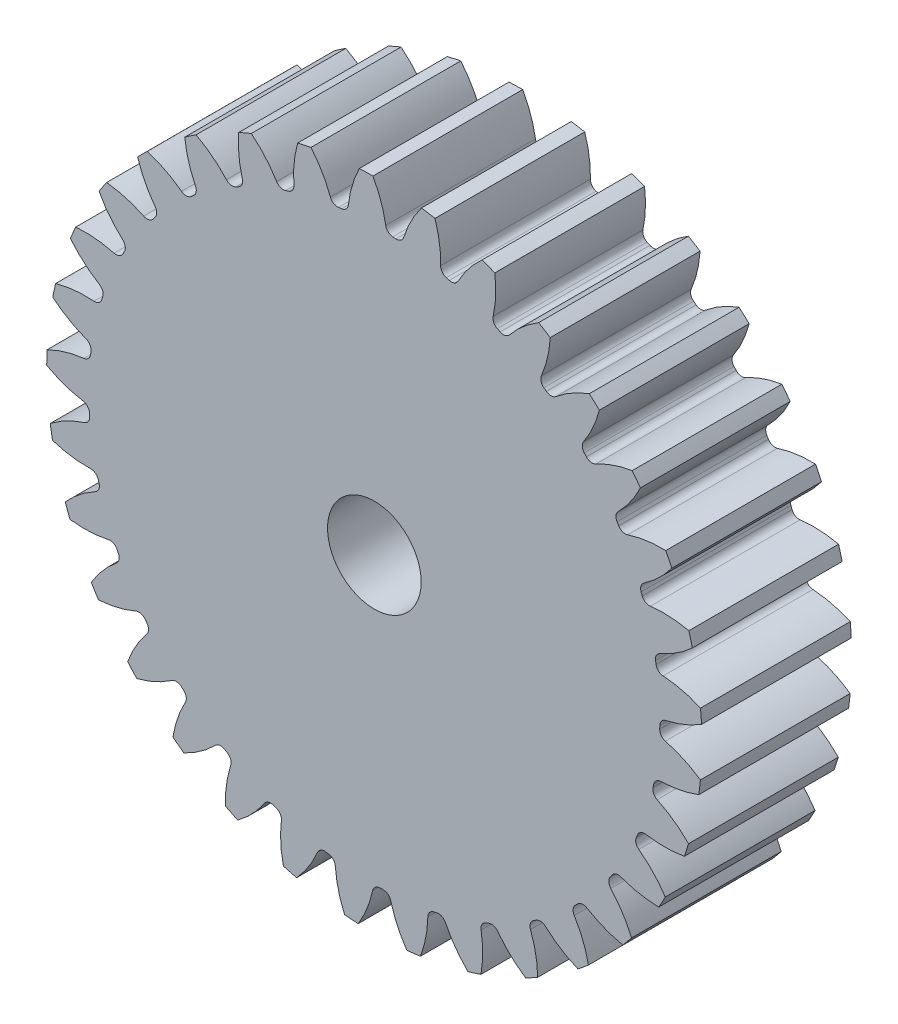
SolidWorks part; units mm, degrees
ref_plane "Front" through (0, 0, 0) normal (0, 0, 1) x (1, 0, 0)
ref_plane "Top" through (0, 0, 0) normal (0, 1, 0) x (1, 0, 0)
ref_plane "Right" through (0, 0, 0) normal (1, 0, 0) x (0, 0, -1)
sketch "Sketch3" plane through (0, 0, 0) normal (0, 0, 1) x (1, 0, 0)
  circle A0 centre (0, 0) radius 222.25
  dimension "od" = 444.5
extrude "gearBody" add sketch "Sketch3" along normal blind 101.6
sketch "Sketch2" plane through (0, 0, 0) normal (0, 0, 1) x (1, 0, 0)
  line L0 (0, 0) -> (181.9235, 75.3552) construction
  line L1 (221.4999, -21.6799) -> (0, 0) construction
  line L2 (0, 0) -> (36.3143, 0) construction
  line L3 (209.4847, 5.2325) -> (209.0383, -14.6347) construction
  line L5 (209.2615, -4.7011) -> (0, 0) construction
  line L7 (0, 0) -> (196.9126, 0) construction
  arc A0 (196.9068, 1.5154) -> (196.6401, -10.3565) centre (0, 0) ccw construction
  arc A1 (221.9511, 11.5226) -> (221.2097, -21.4782) centre (0, 0) ccw construction
  arc A2 (209.4847, 5.2325) -> (209.0383, -14.6347) centre (0, 0) ccw construction
  arc A3 (193.5991, -5.4206) -> (193.6472, -3.2789) centre (0, 0) ccw
  arc A4 (221.4999, -21.6799) -> (197.4557, -10.5654) centre (178.356, -83.4489) ccw
  arc A5 (221.4999, -21.6799) -> (222.25, 11.711) centre (0, 0) ccw
  arc A6 (222.25, 11.711) -> (197.731, 1.6875) centre (181.9235, 75.3552) cw
  arc A7 (193.6472, -3.2789) -> (197.731, 1.6875) centre (198.8154, -3.3664) cw
  arc A8 (197.4557, -10.5654) -> (193.5991, -5.4206) centre (198.766, -5.5653) cw
  point P6 (222.25, 11.711)
  point P22 (221.4999, -21.6799)
  dimension "baseDia" = 393.8252
  dimension "od" = 444.5
  dimension "pd" = 419.1
  dimension "rd" = 387.35
  dimension "rFillet" = 5.1689
  dimension "pointX" = 222.25
  dimension "pointY" = 11.711
  dimension "CTT" = 19.8672
  dimension "flankCenterAngle" = 22.5
extrude "toothCut" cut sketch "Sketch2" along normal through all
pattern_circular "CirPattern1" count 33 over 360 about axis through (0, 0, 0) along (0, 0, 1) of "toothCut"
sketch "hub1Dia" plane through (0, 0, 0) normal (0, 0, -1) x (-1, 0, 0)
  circle A0 centre (0, 0) radius 12.7
  dimension "hub1Dia" = 25.4
sketch "hub2Dia" plane through (0, 0, 101.6) normal (0, 0, 1) x (1, 0, 0)
  circle A0 centre (0, 0) radius 12.7
  dimension "hub2dia" = 25.4
sketch "boreDia" plane through (0, 0, 0) normal (0, 0, 1) x (1, 0, 0)
  circle A0 centre (0, 0) radius 31.75
  dimension "boreDia" = 63.5
extrude "bore" cut sketch "boreDia" against normal mid plane 25400
